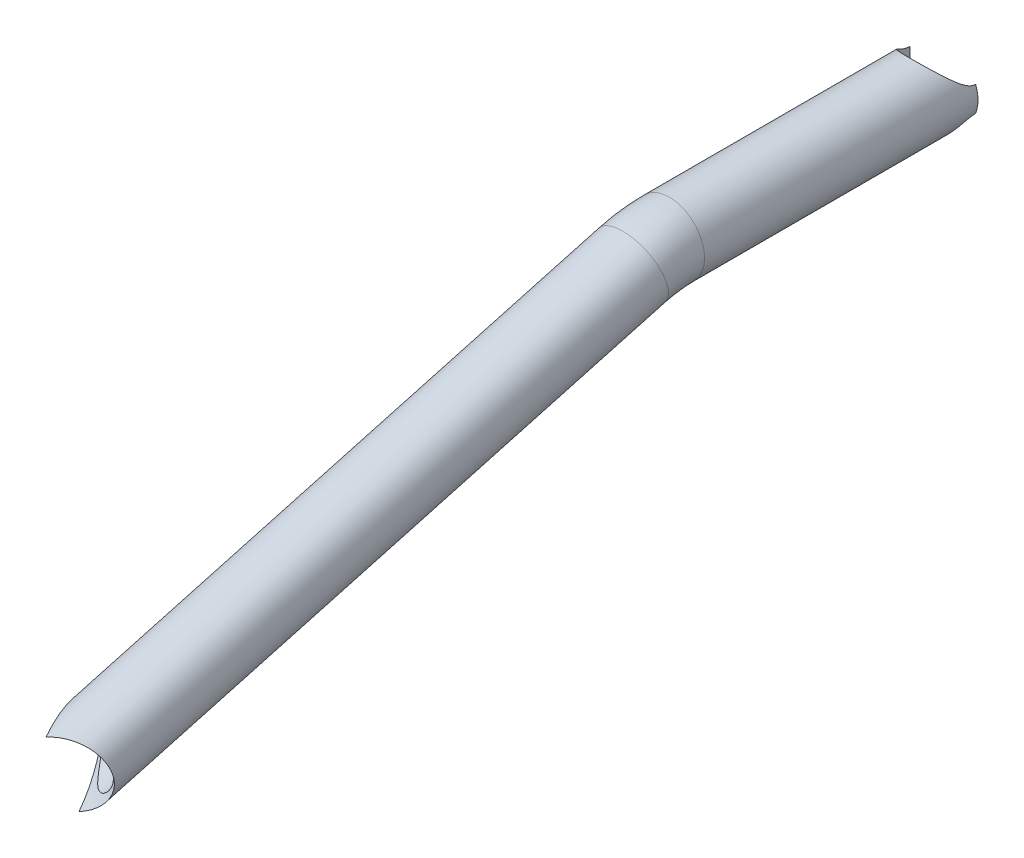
SolidWorks part; units mm, degrees
ref_plane "Plan de face" through (0, 0, 0) normal (0, 0, 1) x (1, 0, 0)
ref_plane "Plan de dessus" through (0, 0, 0) normal (0, 1, 0) x (1, 0, 0)
ref_plane "Plan de droite" through (0, 0, 0) normal (1, 0, 0) x (0, 0, -1)
sketch "Esquisse1" plane through (0, 0, 0) normal (0, 0, 1) x (1, 0, 0)
  line L1 (109.4718, 178.7737) -> (109.4718, 148.7737) construction
  circle A0 centre (109.4718, 163.7737) radius 15
  circle A1 centre (109.4718, 163.7737) radius 13
  dimension "D1" = 30
  dimension "D2" = 26
sketch "Esquisse2" plane through (109.4718, 0, 0) normal (1, 0, 0) x (0, 0, -1)
  line L0 (0, 163.7737) -> (-116.6278, 163.7737)
  line L1 (0, 178.7737) -> (0, 148.7737) construction
  line L2 (-132.4987, 161.6366) -> (-375.4464, 95)
  arc A0 (-116.6278, 163.7737) -> (-132.4987, 161.6366) centre (-116.6278, 103.7737) ccw
  point P7 (-124.7071, 163.7737)
  dimension "D2" = 60
  dimension "D1" = 260
sweep "Balayage1" add profiles "Esquisse1" path "Esquisse2"
sketch "Esquisse3" plane through (0, 178.7737, 0) normal (0, 1, 0) x (1, 0, 0)
  circle A0 centre (109.4718, 0) radius 14 construction
  circle A1 centre (109.4718, 0) radius 14
extrude "Enlèv. mat.-Extru.1" cut sketch "Esquisse3" against normal through all
sketch "Esquisse4" plane through (296.4287, 0, 239.5794) normal (0.7777, 0, 0.6286) x (0.6286, 0, -0.7777)
  circle A0 centre (-223.1876, 95) radius 15 construction
  circle A1 centre (-223.1876, 95) radius 15
extrude "Enlèv. mat.-Extru.2" cut sketch "Esquisse4" against normal through all
